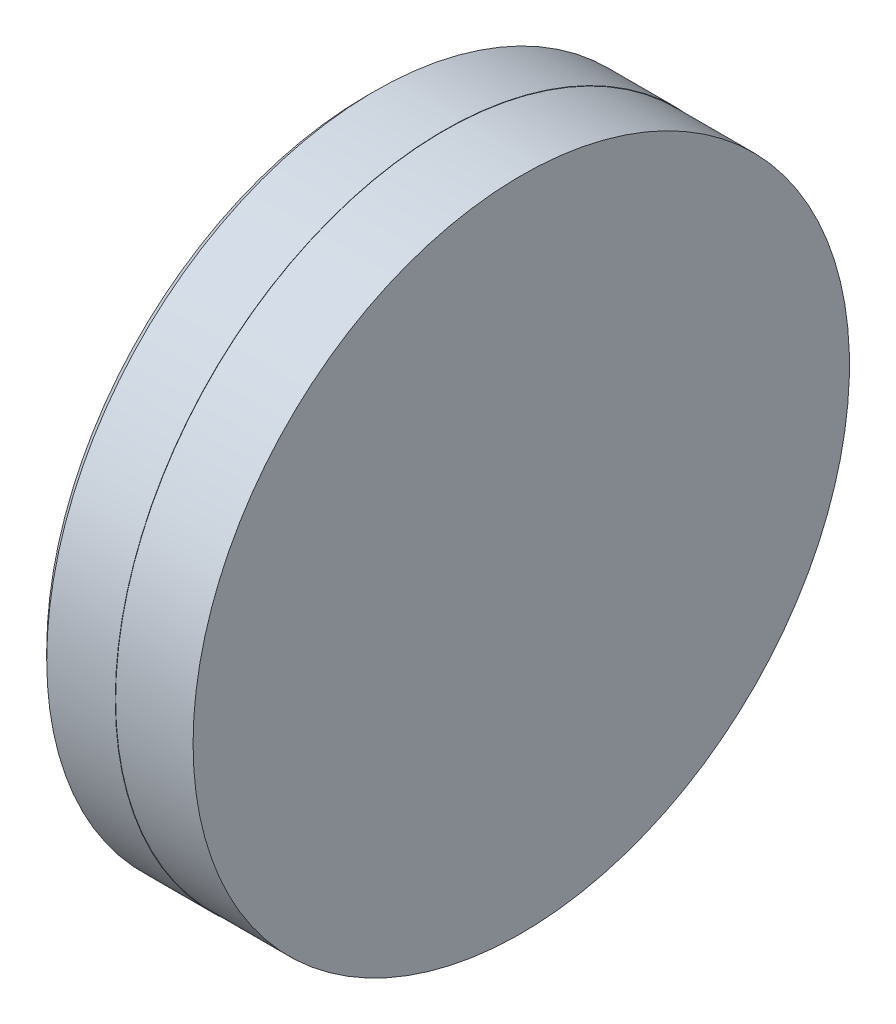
SolidWorks part; units mm, degrees
ref_plane "Front Plane" through (0, 0, 0) normal (0, 0, 1) x (1, 0, 0)
ref_plane "Top Plane" through (0, 0, 0) normal (0, 1, 0) x (1, 0, 0)
ref_plane "Right Plane" through (0, 0, 0) normal (1, 0, 0) x (0, 0, -1)
sketch "Sketch2" plane through (0, 0, 0) normal (0, 0, 1) x (1, 0, 0)
  line L1 (0.25, 9.25) -> (2.18, 9.25)
  line L2 (4.36, 9.24) -> (4.36, -9.24)
  line L3 (2.18, -9.25) -> (0.25, -9.25)
  line L5 (2.18, 9.25) -> (2.18, 9.24)
  line L6 (2.18, -9.24) -> (2.18, -9.25)
  line L7 (4.36, -9.24) -> (2.18, -9.24)
  line L8 (-0.561, 0) -> (5.2517, 0) construction
  line L9 (4.36, 9.24) -> (2.18, 9.24)
  line L10 (0.25, -9.25) -> (0, -9)
  line L12 (0.25, 9.25) -> (0, 9)
  arc A0 (0, 9) -> (0, -9) centre (-10.2118, 0) cw
revolve "Revolve3" add sketch "Sketch2" angle 360 about L8
